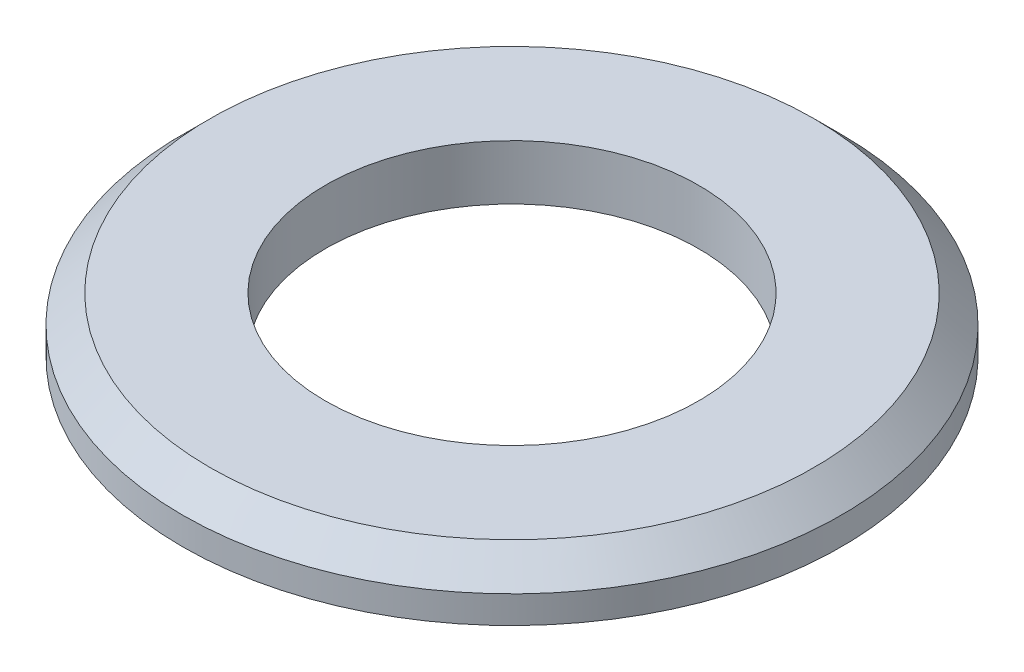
SolidWorks part; units mm, degrees
ref_plane "Front" through (0, 0, 0) normal (0, 0, 1) x (1, 0, 0)
ref_plane "Top" through (0, 0, 0) normal (0, 1, 0) x (1, 0, 0)
ref_plane "Right" through (0, 0, 0) normal (1, 0, 0) x (0, 0, -1)
sketch "Sketch1" plane through (0, 0, 0) normal (0, 1, 0) x (1, 0, 0)
  circle A0 centre (0, 0) radius 17
  circle A1 centre (0, 0) radius 30
extrude "Extrude1" add sketch "Sketch1" along normal blind 5
chamfer "Chamfer1" distance 2.5 1 edges at (0, 5, 30)
